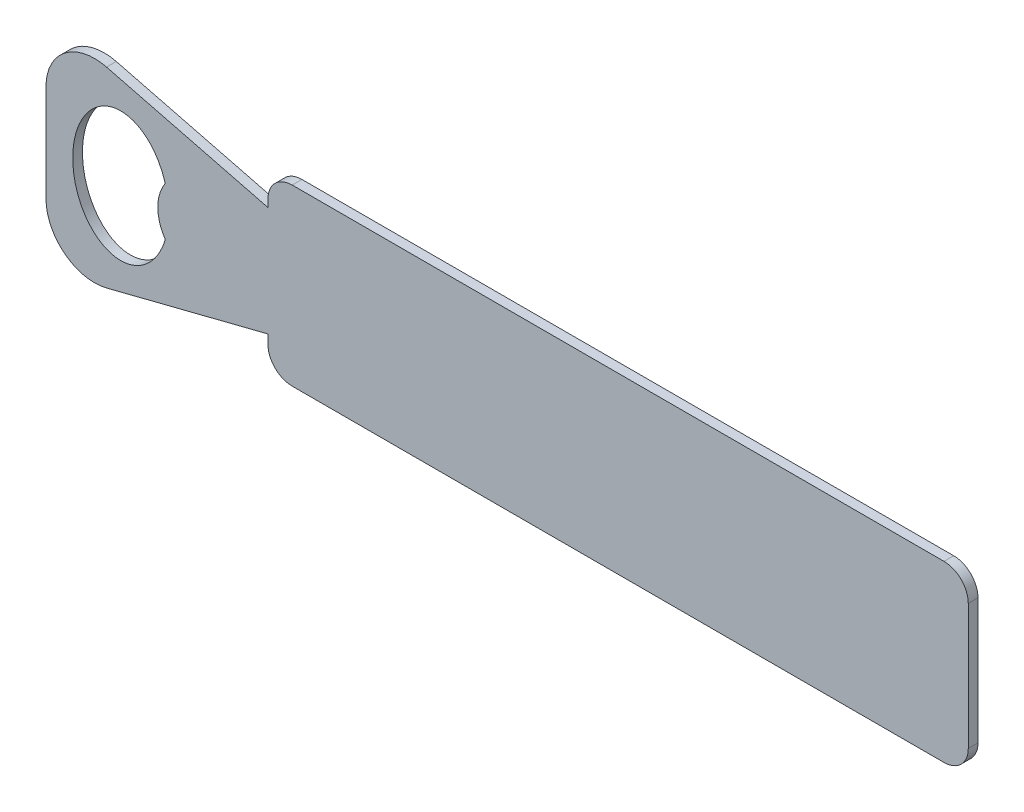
SolidWorks part; units mm, degrees
ref_plane "Front" through (0, 0, 0) normal (0, 0, 1) x (1, 0, 0)
ref_plane "Top" through (0, 0, 0) normal (0, 1, 0) x (1, 0, 0)
ref_plane "Right" through (0, 0, 0) normal (1, 0, 0) x (0, 0, -1)
sketch "Sketch1" plane through (0, 0, 0) normal (0, 0, 1) x (1, 0, 0)
  line L1 (-45.2541, 17.9254) -> (88.9052, 17.9254)
  line L2 (-50.2541, 12.9254) -> (-50.2541, -12.9254)
  line L3 (-45.2541, -17.9254) -> (88.9052, -17.9254)
  line L4 (93.9052, 12.9254) -> (93.9052, -12.9254)
  arc A0 (88.9052, 17.9254) -> (93.9052, 12.9254) centre (88.9052, 12.9254) cw
  arc A1 (88.9052, -17.9254) -> (93.9052, -12.9254) centre (88.9052, -12.9254) ccw
  arc A2 (-50.2541, -12.9254) -> (-45.2541, -17.9254) centre (-45.2541, -12.9254) ccw
  arc A3 (-45.2541, 17.9254) -> (-50.2541, 12.9254) centre (-45.2541, 12.9254) ccw
  point P4 (-50.2541, 0)
  dimension "D1" = 5
extrude "Extrude1" add sketch "Sketch1" along normal blind 2
sketch "Sketch2" plane through (0, 0, 0) normal (0, 0, 1) x (1, 0, 0)
  line L4 (-5.7992, 0.1533) -> (-83.4718, 19.8466)
  line L5 (-5.7992, 0.1533) -> (-83.4718, -19.5399)
  line L6 (-95.9294, 10.1533) -> (-95.9294, -9.8467)
  arc A6 (-83.4718, 19.8466) -> (-95.9294, 10.1533) centre (-85.9294, 10.1533) ccw
  arc A7 (-83.4718, -19.5399) -> (-95.9294, -9.8467) centre (-85.9294, -9.8467) cw
  dimension "D1" = 10
  dimension "D6" = 40
extrude "Extrude2" add sketch "Sketch2" along normal through all
sketch "Sketch3" plane through (0, 0, 0) normal (0, 0, 1) x (1, 0, 0)
  ellipse E0 centre (-80.5423, 0.1533) end of major axis (-80.5423, 13.4973) minor radius 9.8851
extrude "Cut-Extrude1" cut sketch "Sketch3" along normal through all
sketch "Sketch4" plane through (0, 0, 0) normal (0, 0, 1) x (1, 0, 0)
  circle A0 centre (-64.0645, 0.1533) radius 8.8542
extrude "Extrude3" add sketch "Sketch4" along normal through all
